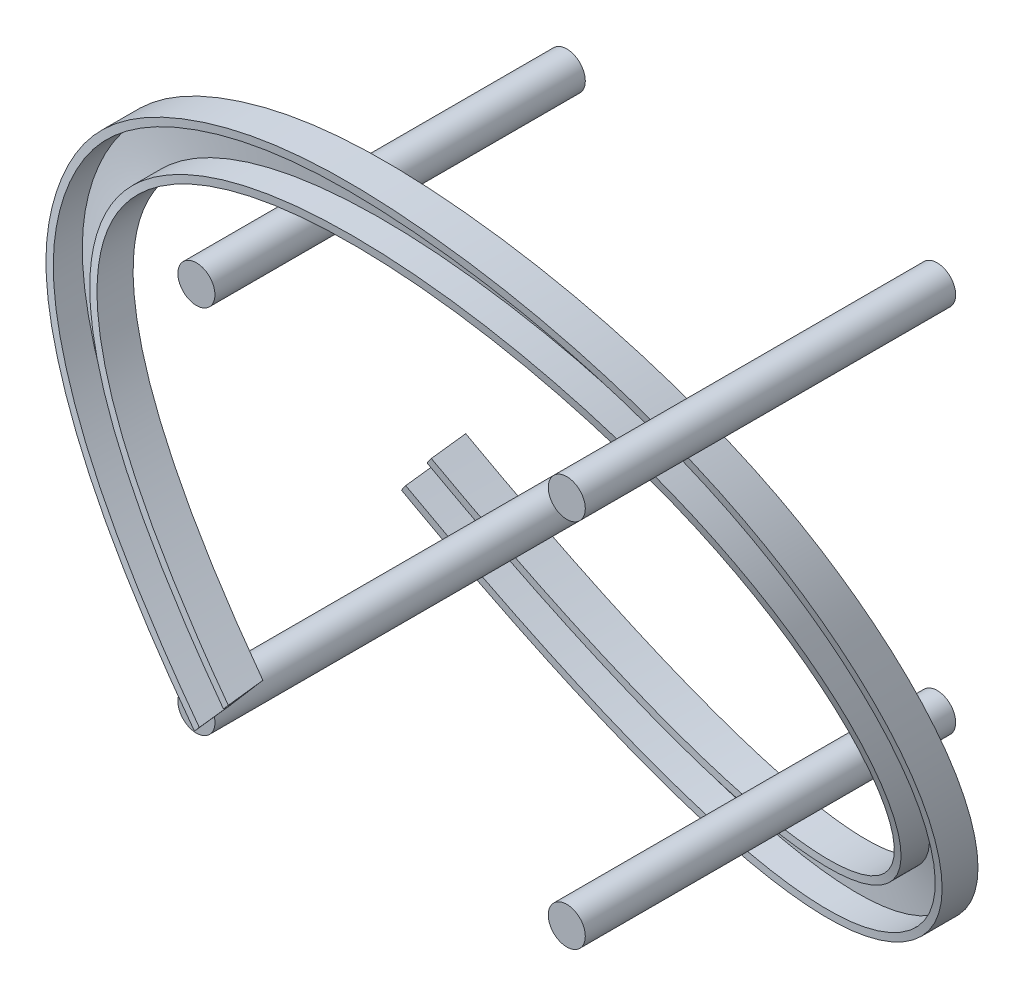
SolidWorks part; units mm, degrees
ref_plane "Ebene vorne" through (0, 0, 0) normal (0, 0, 1) x (1, 0, 0)
ref_plane "Ebene oben" through (0, 0, 0) normal (0, 1, 0) x (1, 0, 0)
ref_plane "Ebene rechts" through (0, 0, 0) normal (1, 0, 0) x (0, 0, -1)
sketch "Skizze1" plane through (0, 0, 0) normal (0, 0, 1) x (1, 0, 0)
  line L0 (0, 43.8765) -> (0, -44.7122) construction
  line L1 (-52.1582, 0) -> (68.4672, 0) construction
  circle A0 centre (-50, 50) radius 5
  circle A1 centre (50, 50) radius 5
  circle A2 centre (50, -50) radius 5
  circle A3 centre (-50, -50) radius 5
  dimension "D1" = 10
  dimension "D2" = 50
  dimension "D3" = 50
extrude "Linear austragen1" add sketch "Skizze1" along normal blind 100
ref_plane "Ebene1" through (0, 0, 25) normal (0, 0, -1) x (-1, 0, 0)
ref_plane "Ebene2" through (0, 0, 50) normal (0, 0, -1) x (-1, 0, 0)
ref_plane "Ebene3" through (0, 0, 75) normal (0, 0, -1) x (-1, 0, 0)
sketch "Skizze2" plane through (0, 0, 0) normal (0, 0, 1) x (1, 0, 0)
  point P0 (-77.2854, -48.6074)
sketch "Skizze3" plane through (0, 0, 25) normal (0, 0, -1) x (-1, 0, 0)
  point P0 (-70.0633, -43.8293)
sketch "Skizze4" plane through (0, 0, 50) normal (0, 0, -1) x (-1, 0, 0)
  point P0 (-46.4445, 19.3418)
sketch "Skizze5" plane through (0, 0, 75) normal (0, 0, -1) x (-1, 0, 0)
  point P0 (72.7768, 54.2341)
sketch "Skizze6" plane through (0, 0, 100) normal (0, 0, 1) x (1, 0, 0)
  point P0 (-32.0569, -33.6605)
sketch3d "3D-Skizze1"
  spline S0 degree 3 poles (-77.2854, -48.6074, 0) (62.5636, -147.2608, -14.2018) (141.1707, 74.9173, 72.1431) (-164.44, 80.2015, 71.9648) (-32.0569, -33.6605, 100) knots 0 0 0 0 0.494089 1 1 1 1
ref_plane "Ebene4" through (-77.2854, -48.6074, 0) normal (0.8143, -0.5745, -0.0827) x (0.5764, 0.8172, -0.0002)
sketch "Skizze7" plane through (-77.2854, -48.6074, 0) normal (0.8143, -0.5745, -0.0827) x (0.5764, 0.8172, -0.0002)
  line L0 (0, 10) -> (0, 0)
  line L1 (0, 0) -> (-14, 0)
  line L2 (-14, 0) -> (-14, 10)
  line L3 (-14, 10) -> (-12, 10)
  line L4 (-12, 10) -> (-12, 2)
  line L5 (-12, 2) -> (-2, 2)
  line L6 (-2, 2) -> (-2, 10)
  line L7 (-2, 10) -> (0, 10)
  dimension "D1" = 2
  dimension "D2" = 2
  dimension "D3" = 2
  dimension "D4" = 10
  dimension "D5" = 10
sweep "Austragung1" add profiles "Skizze7" path "3D-Skizze1"
